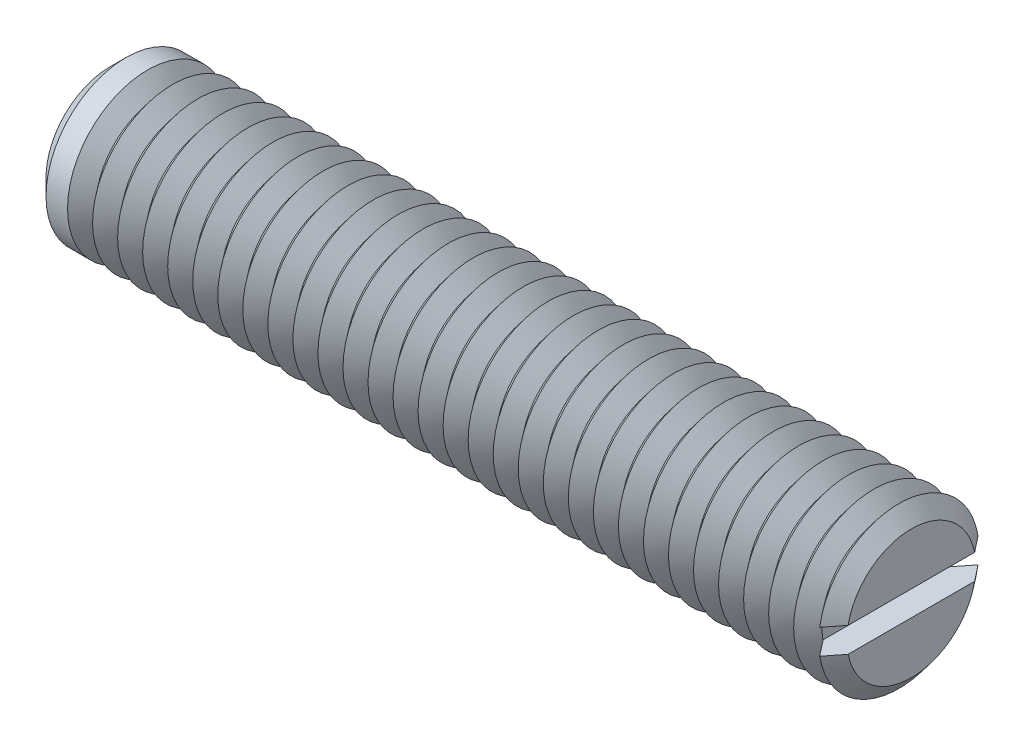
SolidWorks part; units mm, degrees
ref_plane "Front Plane" through (0, 0, 0) normal (0, 0, 1) x (1, 0, 0)
ref_plane "Top Plane" through (0, 0, 0) normal (0, 1, 0) x (1, 0, 0)
ref_plane "Right Plane" through (0, 0, 0) normal (1, 0, 0) x (0, 0, -1)
sketch "Sketch1" plane through (0, 0, 0) normal (1, 0, 0) x (0, 0, -1)
  circle A0 centre (0, 0) radius 4
  dimension "D1" = 8
extrude "Extrude1" add sketch "Sketch1" along normal mid plane 40
sketch "Sketch2" plane through (0, 0, 0) normal (0, 0, 1) x (1, 0, 0)
  line L0 (20, 0.625) -> (18.75, 0.625)
  line L1 (20, -4) -> (20, 4) construction
  line L2 (18.75, 0.625) -> (18.75, -0.625)
  line L3 (0, 0) -> (50000, 0) construction
  line L4 (20, -0.625) -> (18.75, -0.625)
  line L5 (20, -0.625) -> (20, 0.625)
  point P9 (18.75, 0)
  dimension "D1" = 1.25
extrude "Extrude2" cut sketch "Sketch2" against normal mid plane 12
chamfer "Chamfer1" distance 0.8 angle 45 1 edges at (-20, 0, -4)
sketch "Sketch3" plane through (0, 0, 0) normal (0, 0, 1) x (1, 0, 0)
  line L0 (0, 0) -> (30.9602, 0) construction
  line L1 (19.375, -4) -> (20.625, -4)
  line L2 (-19.2, -4) -> (20, -4) construction
  line L3 (20.625, -4) -> (20, -3.2194)
  line L4 (20, -4) -> (20, -0.625) construction
  line L5 (20, -3.2194) -> (19.375, -4)
  dimension "D1" = 1.25
  dimension "D2" = 1
revolve "Cut-Revolve1" cut sketch "Sketch3" angle 360 about L0
pattern_linear "LPattern1" count 31 spacing 1.25 along (-1, 0, 0) of "Cut-Revolve1"
equation "\"D2@Sketch3\" = \"D1@Sketch3\"*0.8"
